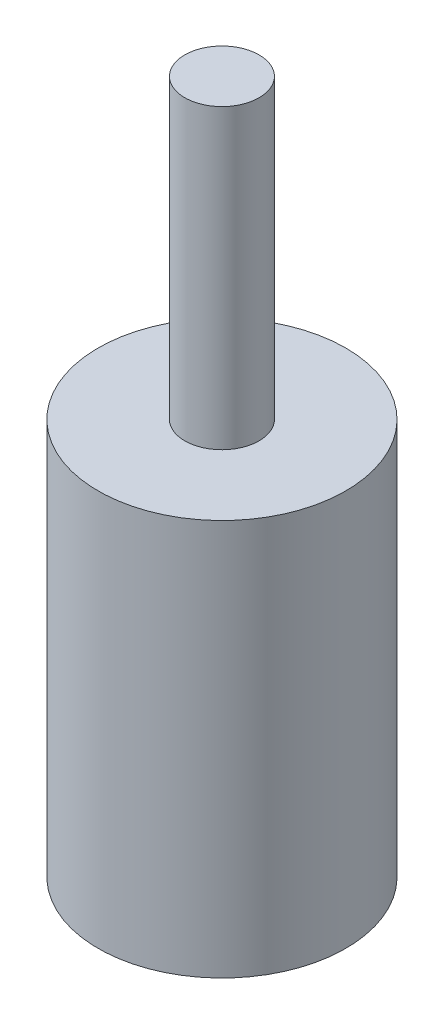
SolidWorks part; units mm, degrees
ref_plane "Front Plane" through (0, 0, 0) normal (0, 0, 1) x (1, 0, 0)
ref_plane "Top Plane" through (0, 0, 0) normal (0, 1, 0) x (1, 0, 0)
ref_plane "Right Plane" through (0, 0, 0) normal (1, 0, 0) x (0, 0, -1)
sketch "Sketch3" plane through (0, 0, 0) normal (0, 1, 0) x (1, 0, 0)
  circle A0 centre (0, 0) radius 1.905
  dimension "D1" = 3.81
extrude "Boss-Extrude1" add sketch "Sketch3" along normal blind 15.24
sketch "Sketch4" plane through (0, 0, 0) normal (0, -1, 0) x (1, 0, 0)
  circle A0 centre (0, 0) radius 6.35
  dimension "D1" = 12.7
extrude "Boss-Extrude2" add sketch "Sketch4" along normal blind 20.32
sketch "Sketch5" plane through (0, -20.32, 0) normal (0, -1, 0) x (1, 0, 0)
  line L0 (-2.3659, 2.6547) -> (1.1413, 3.3679)
  arc A2 (-2.3659, 2.6547) -> (1.1413, 3.3679) centre (0, 0) ccw
  dimension "D1" = 3.556
  dimension "D2" = 3.579
extrude "Cut-Extrude1" cut sketch "Sketch5" against normal blind 15.24
